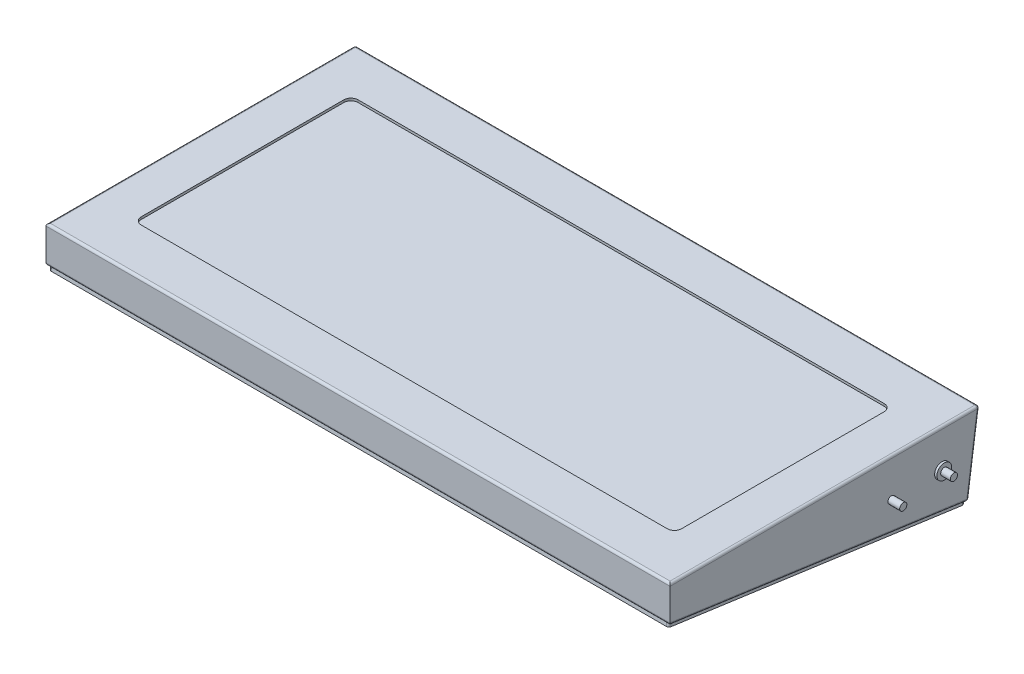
SolidWorks part; units mm, degrees
ref_plane "Front Plane" through (0, 0, 0) normal (0, 0, 1) x (1, 0, 0)
ref_plane "Top Plane" through (0, 0, 0) normal (0, 1, 0) x (1, 0, 0)
ref_plane "Right Plane" through (0, 0, 0) normal (1, 0, 0) x (0, 0, -1)
sketch "Sketch2" plane through (0, 0, 0) normal (1, 0, 0) x (0, 0, -1)
  line L0 (-7.2962, -51.9154) -> (0, 0)
  line L1 (0, 0) -> (-206.6855, 0)
  line L2 (-206.6855, 0) -> (-206.6608, -24.1046)
  line L4 (-7.2962, -51.9154) -> (-206.6608, -24.1046)
  point P0 (0, 0)
  dimension "D1" = 98
  dimension "D2" = 201.295
  dimension "D3" = 52.4256
  dimension "D4" = 24.1046
  dimension "D5" = 82
extrude "Enclosure Body" add sketch "Sketch2" along normal mid plane 416.56
fillet "Radii" radius 1.524 10 edges at (0, 0, 0) (208.28, 0, 103.3427) (0, 0, 206.6855) (-208.28, 0, 103.3427) (-208.28, -25.9577, 3.6481) (208.28, -25.9577, 3.6481) (-208.28, -38.01, 106.9785) (0, -24.1046, 206.6608) (208.28, -38.01, 106.9785) (0, -51.9154, 7.2962)
sketch "Sketch3" plane through (0, 0, 0) normal (0, 1, 0) x (1, 0, 0)
  line L1 (-175.5648, -31.0665) -> (175.5648, -31.0665)
  line L2 (-180.34, -35.8417) -> (-180.34, -171.0713)
  line L3 (-175.5648, -175.8465) -> (175.5648, -175.8465)
  line L4 (180.34, -35.8417) -> (180.34, -171.0713)
  line L6 (-206.756, -1.7532) -> (-206.756, -205.1599) construction
  arc A0 (-180.34, -171.0713) -> (-175.5648, -175.8465) centre (-175.5648, -171.0713) ccw
  arc A1 (175.5648, -175.8465) -> (180.34, -171.0713) centre (175.5648, -171.0713) ccw
  arc A2 (175.5648, -31.0665) -> (180.34, -35.8417) centre (175.5648, -35.8417) cw
  arc A3 (-175.5648, -31.0665) -> (-180.34, -35.8417) centre (-175.5648, -35.8417) ccw
  point P4 (0, -31.0665)
  point P5 (-180.34, -103.4565)
  point P10 (-180.34, -175.8465)
  point P13 (180.34, -175.8465)
  point P18 (-180.34, -31.0665)
  point P20 (-206.756, -103.4565)
  dimension "D4" = 4.7752
  dimension "D1" = 360.68
  dimension "D2" = 144.78
extrude "Keys Extrude" cut sketch "Sketch3" against normal blind 1.6002
sketch "Sketch9" plane through (208.28, 0, 0) normal (1, 0, 0) x (0, 0, -1)
  circle A0 centre (-58.928, -25.4) radius 2.3876
  circle A1 centre (-25.146, -25.146) radius 2.413
  dimension "D1" = 4.7752
  dimension "D2" = 4.826
  dimension "D3" = 58.928
  dimension "D4" = 25.4
  dimension "D5" = 25.146
  dimension "D6" = 25.146
extrude "Pins, Right Side" add sketch "Sketch9" along normal blind 7.9248
mirror "Pins, Left Side" about plane through (0, 0, 0) normal (1, 0, 0) of "Pins, Right Side"
sketch "Sketch10" plane through (-208.28, 0, 0) normal (-1, 0, 0) x (0, 0, 1)
  circle A0 centre (25.146, -25.146) radius 2.413 construction
  circle A1 centre (25.146, -25.146) radius 2.413 construction
  circle A2 centre (25.146, -25.146) radius 5.9817
  dimension "D1" = 11.9634
extrude "Pin, Weld Nut" add sketch "Sketch10" along normal blind 9.525
sketch "Sketch4" plane through (0, -51.9228, 7.2431) normal (0, -0.9904, 0.1382) x (1, 0, 0)
  line L7 (-205.232, 200.517) -> (205.232, 200.517)
  line L8 (206.756, 198.993) -> (206.756, 2.5921)
  line L9 (205.232, 1.0681) -> (-205.232, 1.0681)
  line L10 (-206.756, 2.5921) -> (-206.756, 198.993)
  line L11 (-208.28, 1.5761) -> (-208.28, 201.5628) construction
  line L12 (208.28, 201.5628) -> (208.28, 1.5761) construction
  line L13 (-208.2652, 201.533) -> (208.2652, 201.533) construction
  line L14 (206.756, 0.0521) -> (-206.756, 0.0521) construction
  arc A4 (-206.756, 2.5921) -> (-205.232, 1.0681) centre (-205.232, 2.5921) ccw
  arc A5 (206.756, 2.5921) -> (205.232, 1.0681) centre (205.232, 2.5921) cw
  arc A6 (206.756, 198.993) -> (205.232, 200.517) centre (205.232, 198.993) ccw
  arc A7 (-205.232, 200.517) -> (-206.756, 198.993) centre (-205.232, 198.993) ccw
  dimension "D3" = 1.524
  dimension "D1" = 1.524
  dimension "D2" = 1.524
  dimension "D4" = 1.016
  dimension "D5" = 1.016
  dimension "D6" = 199.4489
  dimension "D7" = 413.512
extrude "Sub-panel Emboss" add sketch "Sketch4" along normal blind 2.286
sketch "Sketch11" plane through (0, -54.1869, 7.5589) normal (0, -0.9904, 0.1382) x (1, 0, 0)
  line L0 (-206.756, 198.993) -> (-206.756, 2.5921) construction
  circle A0 centre (0, 100.7926) radius 9.525
  point P2 (0, 0)
  point P4 (0, 0)
  point P9 (-206.756, 100.7926)
  dimension "D1" = 19.05
extrude "Gore Vent" add sketch "Sketch11" along normal blind 6.35
sketch "Sketch12" plane through (-217.805, 0, 0) normal (-1, 0, 0) x (0, 0, 1)
  circle A0 centre (25.146, -25.146) radius 3.937
  dimension "D1" = 7.874
extrude "Cable Entry" cut sketch "Sketch12" against normal blind 12.7
sketch "Sketch13" plane through (208.28, 0, 0) normal (1, 0, 0) x (0, 0, -1)
  circle A0 centre (-25.146, -25.146) radius 4.953
  dimension "D1" = 9.906
extrude "Washer, Right Side" add sketch "Sketch13" along normal blind 1.524
sketch "Sketch14" plane through (-208.28, 0, 0) normal (-1, 0, 0) x (0, 0, 1)
  circle A0 centre (25.146, -25.146) radius 17.526
  dimension "D1" = 35.052
extrude "Washer, Left Side" add sketch "Sketch14" along normal blind 1.524
